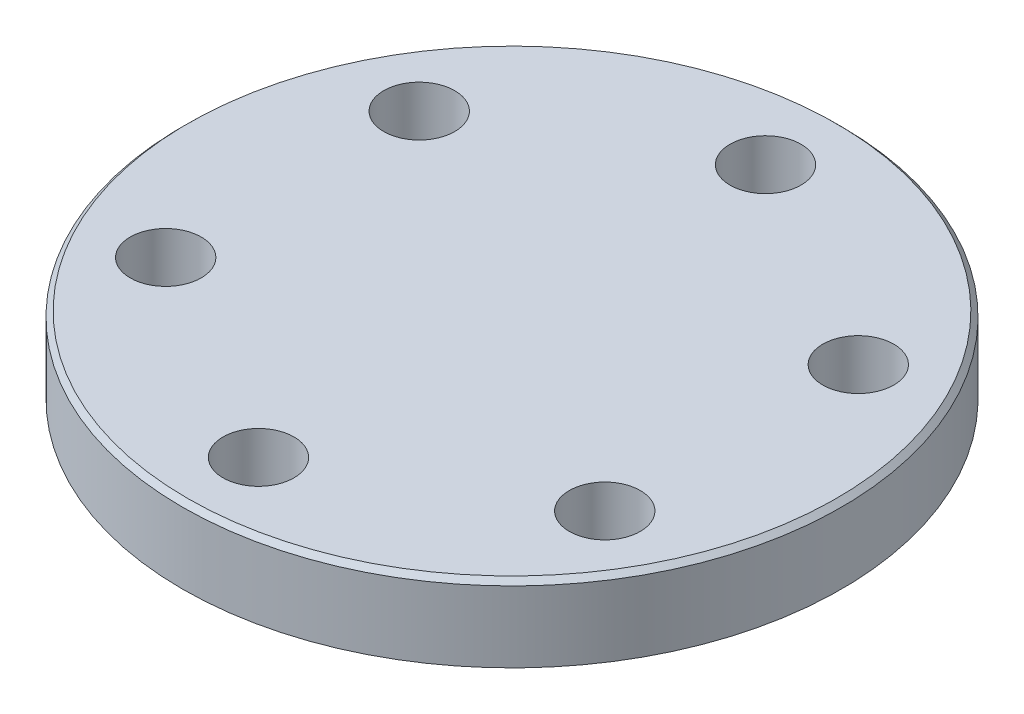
SolidWorks part; units mm, degrees
ref_plane "Face" through (0, 0, 0) normal (0, 0, 1) x (1, 0, 0)
ref_plane "Dessus" through (0, 0, 0) normal (0, 1, 0) x (1, 0, 0)
ref_plane "Droite" through (0, 0, 0) normal (1, 0, 0) x (0, 0, -1)
sketch "Esquisse1" plane through (0, 0, 0) normal (0, 0, 1) x (1, 0, 0)
  line L0 (0, -775.6) -> (0, -634.4) construction
  line L5 (0, -830) -> (65, -830)
  line L6 (65, -830) -> (65, -845)
  line L7 (65, -845) -> (0, -845)
  line L8 (0, -845) -> (0, -830)
  dimension "D2" = 15
  dimension "D5" = 130
revolve "Base-Révolution" add sketch "Esquisse1" angle 360 about L0
chamfer "Chanfrein1" distance 1 angle 45 1 edges at (0, -830, -65)
sketch "Esquisse3" plane through (0, -830, 0) normal (0, 1, 0) x (1, 0, 0)
  circle A0 centre (0, 0) radius 64 construction
  circle A1 centre (0, 0) radius 64
sketch "Esquisse4" plane through (0, -830, 0) normal (0, 1, 0) x (1, 0, 0)
  circle A0 centre (-60, 0) radius 8
  dimension "D1" = 16
  dimension "D2" = 60
extrude "Enlèv. mat.-Extru.1" [suppressed] cut sketch "Esquisse4" against normal through all
pattern_circular "Répétition circulaire1" [suppressed] count 4 over 360
sketch "Esquisse5" plane through (0, -830, 0) normal (0, 1, 0) x (1, 0, 0)
  circle A0 centre (0, 50) radius 7
  dimension "D1" = 50
  dimension "D2" = 14
extrude "Enlèv. mat.-Extru.2" cut sketch "Esquisse5" against normal through all
pattern_circular "Répétition circulaire2" count 6 over 360 about axis through (0, 0, 0) along (0, 1, 0) of "Enlèv. mat.-Extru.2"
